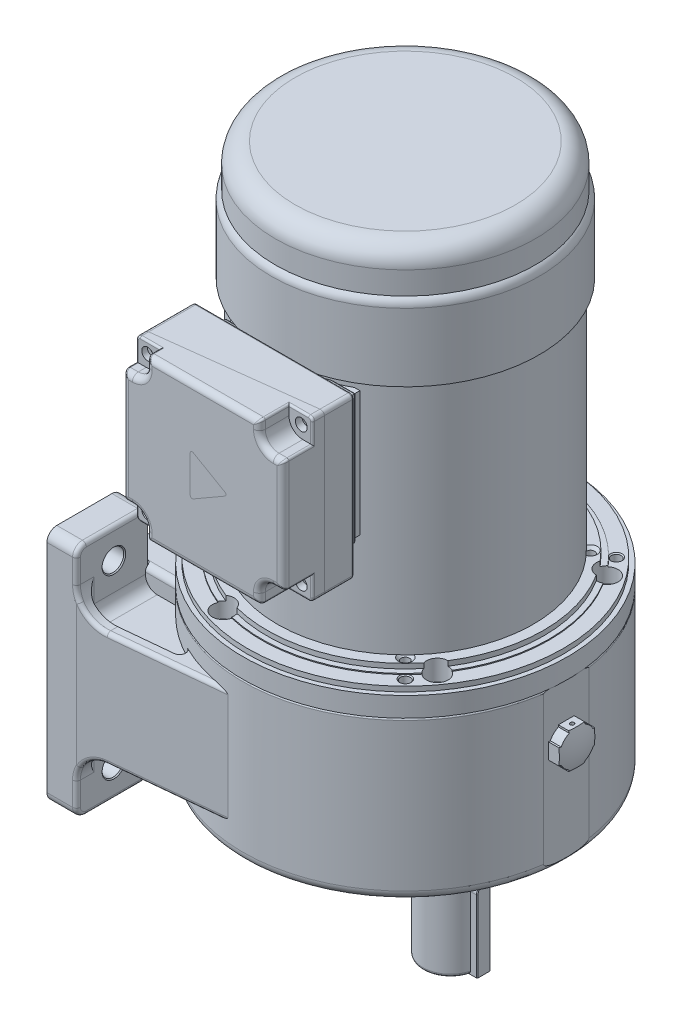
SolidWorks part; units mm, degrees
ref_plane "前视基准面" through (0, 0, 0) normal (0, 0, 1) x (1, 0, 0)
ref_plane "上视基准面" through (0, 0, 0) normal (0, 1, 0) x (1, 0, 0)
ref_plane "右视基准面" through (0, 0, 0) normal (1, 0, 0) x (0, 0, -1)
imported_body "接线盒座-1-surface1"
imported_body "接线盒座-1-surface2"
imported_body "接线盒座-1-surface3"
imported_body "接线盒座-1-surface4"
imported_body "接线盒座-1-surface5"
imported_body "接线盒座-1-surface6"
imported_body "接线盒盖-1-surface1"
imported_body "接线盒盖-1-surface2"
imported_body "接线盒盖-1-surface3"
imported_body "接线盒盖-1-surface4"
imported_body "卧式箱体装配体-1/A版修模 28箱体-1-surface1"
imported_body "卧式箱体装配体-1/A版修模 28箱体-1-surface2"
imported_body "卧式箱体装配体-1/A版修模 28箱体-1-surface3"
imported_body "卧式箱体装配体-1/A版修模 28箱体-1-surface4"
imported_body "卧式箱体装配体-1/A版修模 28箱体-1-surface5"
imported_body "卧式箱体装配体-1/A版修模 28箱体-1-surface6"
imported_body "卧式箱体装配体-1/A版修模 28箱体-1-surface7"
imported_body "卧式箱体装配体-1/A版修模 28箱体-1-surface8"
imported_body "卧式箱体装配体-1/A版修模 28箱体-1-surface9"
imported_body "卧式箱体装配体-1/A版修模 28箱体-1-surface10"
imported_body "卧式箱体装配体-1/A版修模 28箱体-1-surface11"
imported_body "卧式箱体装配体-1/16.04.20 28箱盖配B版电机1500-1-surface1"
imported_body "卧式箱体装配体-1/16.04.20 28箱盖配B版电机1500-1-surface2"
imported_body "卧式箱体装配体-1/GB／T13871．1-2007唇形密封圈B型B15 30X45X7-1-surface1"
imported_body "卧式箱体装配体-1/透气塞-1-surface1"
imported_body "卧式箱体装配体-1/7X40-1-surface1"
sketch "草图1" plane through (0, -131.8128, 0) normal (0, 1, 0) x (1, 0, 0)
  circle A0 centre (97.6607, -10.8395) radius 65
extrude "凸台-拉伸1" add sketch "草图1" along normal blind 120
sketch "草图2" plane through (0, -11.8128, 0) normal (0, 1, 0) x (1, 0, 0)
  circle A0 centre (97.6607, -10.8395) radius 68
extrude "凸台-拉伸2" add sketch "草图2" along normal blind 33.5
sketch "草图3" plane through (0, 21.6872, 0) normal (0, 1, 0) x (1, 0, 0)
  circle A0 centre (97.6607, -10.8395) radius 68
extrude "凸台-拉伸3" add sketch "草图3" along normal blind 5
sketch "草图4" plane through (0, 26.6872, 0) normal (0, 1, 0) x (1, 0, 0)
  circle A0 centre (97.6607, -10.8395) radius 66
extrude "凸台-拉伸4" add sketch "草图4" along normal blind 21.5
fillet "圆角1" radius 10 1 edges at (97.6607, 48.1872, 76.8395)
fillet "圆角2" radius 5 1 edges at (97.6607, 26.6872, 78.8395)
